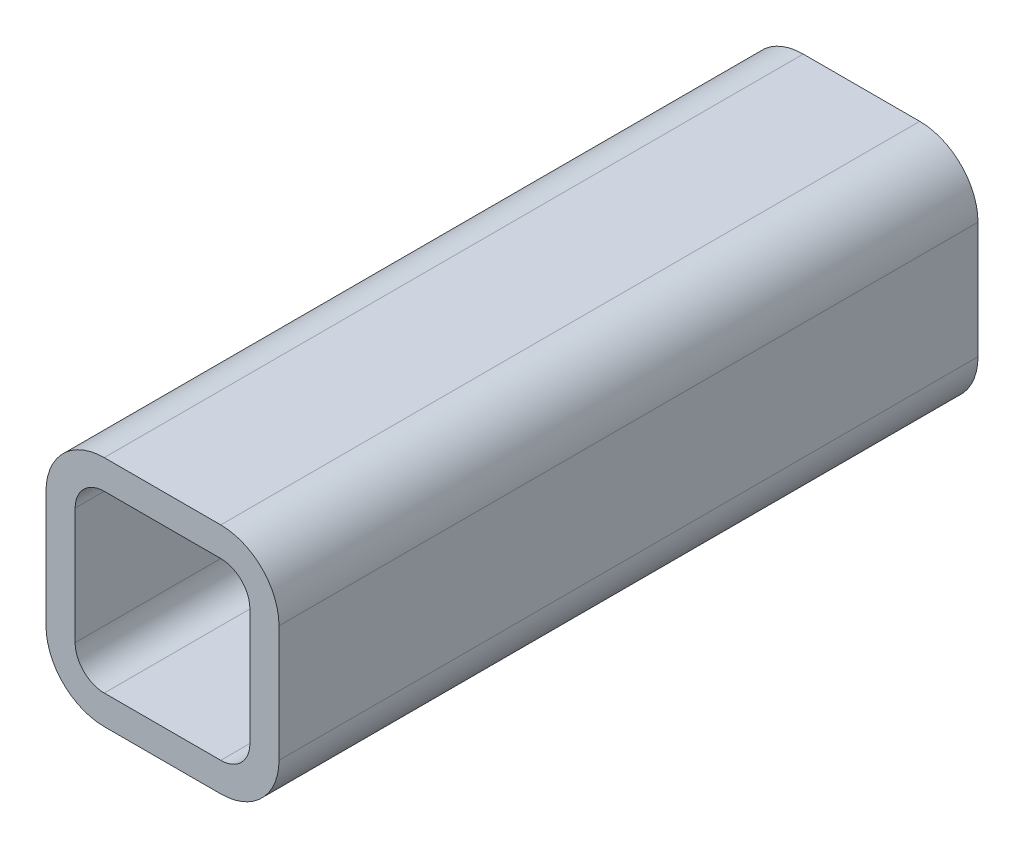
SolidWorks part; units mm, degrees
ref_plane "Front Plane" through (0, 0, 0) normal (0, 0, 1) x (1, 0, 0)
ref_plane "Top Plane" through (0, 0, 0) normal (0, 1, 0) x (1, 0, 0)
ref_plane "Right Plane" through (0, 0, 0) normal (1, 0, 0) x (0, 0, -1)
sketch "Sketch1" plane through (0, 0, 0) normal (0, 0, 1) x (1, 0, 0)
sketch_block_instance "HSS4x4x0.500-1"
sketch_block "HSS4x4x0.500"
extrude "Boss-Extrude1" add sketch "Sketch1" along normal blind 304.8
